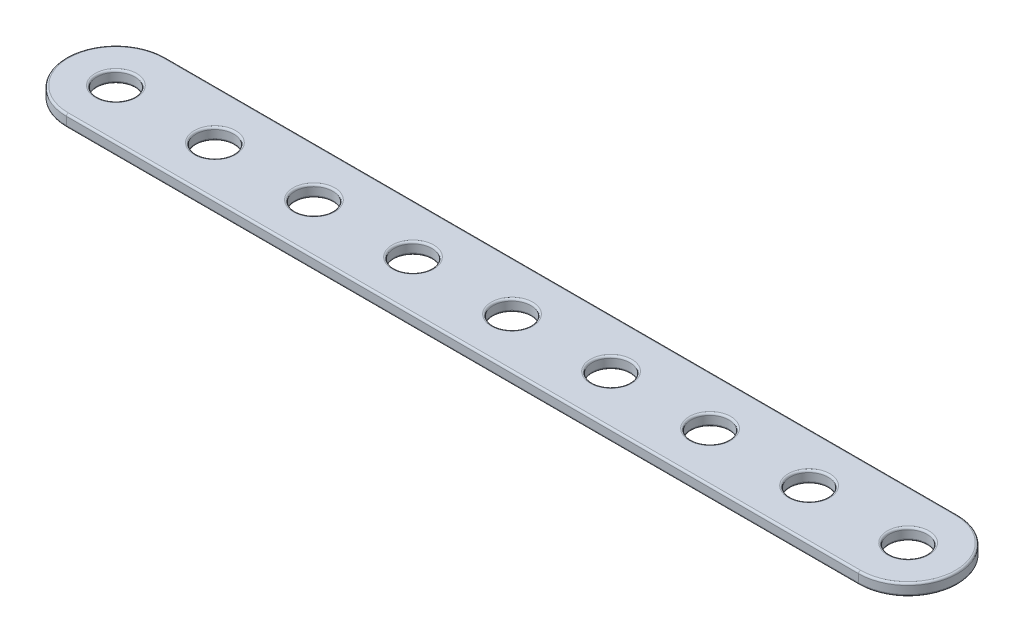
SolidWorks part; units mm, degrees
ref_plane "Front" through (0, 0, 0) normal (0, 0, 1) x (1, 0, 0)
ref_plane "Top" through (0, 0, 0) normal (0, 1, 0) x (1, 0, 0)
ref_plane "Right" through (0, 0, 0) normal (1, 0, 0) x (0, 0, -1)
sketch "Sketch1" plane through (0, 0, 0) normal (0, 1, 0) x (1, 0, 0)
  line L1 (0, 0) -> (101.6, 0)
  line L3 (0, 12.7) -> (101.6, 12.7)
  arc A0 (0, 12.7) -> (0, 0) centre (0, 6.35) ccw
  arc A1 (101.6, 0) -> (101.6, 12.7) centre (101.6, 6.35) ccw
  dimension "D1" = 12.7
  dimension "D2" = 101.6
extrude "Extrude1" add sketch "Sketch1" along normal blind 1.524
sketch "Sketch2" plane through (0, 1.524, 0) normal (0, 1, 0) x (-1, 0, 0)
  line L0 (-101.6, -12.7) -> (0, -12.7) construction
  circle A0 centre (0, -6.35) radius 2.413
  dimension "D2" = 4.826
  dimension "D1" = 6.35
extrude "Cut-Extrude1" cut sketch "Sketch2" against normal through all
pattern_linear "LPattern1" count 9 spacing 12.7 along (1, 0, 0) of "Cut-Extrude1"
fillet "Fillet1" radius 0.254 26 edges at (107.95, 1.524, -6.35) (50.8, 1.524, -12.7) (0, 0, -3.937) (0, 1.524, -3.937) (12.7, 0, -3.937) (12.7, 1.524, -3.937) (25.4, 0, -3.937) (25.4, 1.524, -3.937) (38.1, 0, -3.937) (38.1, 1.524, -3.937) (50.8, 0, -3.937) (50.8, 1.524, -3.937) (63.5, 0, -3.937) (63.5, 1.524, -3.937) (76.2, 0, -3.937) (76.2, 1.524, -3.937) (-6.35, 1.524, -6.35) (50.8, 0, -12.7) (88.9, 0, -3.937) (88.9, 1.524, -3.937) (107.95, 0, -6.35) (101.6, 0, -3.937) (101.6, 1.524, -3.937) (50.8, 0, 0) (-6.35, 0, -6.35) (50.8, 1.524, 0)
equation "\"D2@Sketch1\" = \"D3@LPattern1\" *  ( \"D1@LPattern1\" - 1 ) "
